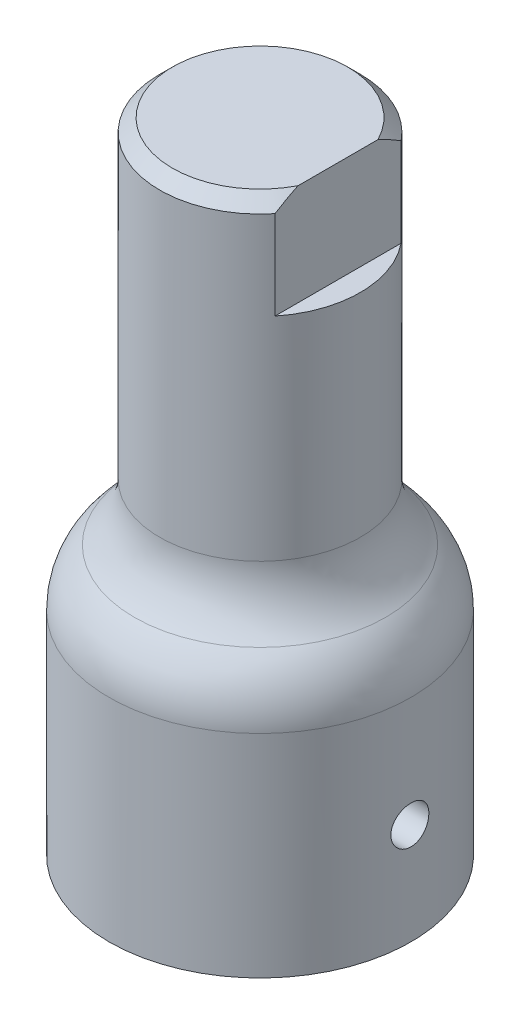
SolidWorks part; units mm, degrees
ref_plane "Front" through (0, 0, 0) normal (0, 0, 1) x (1, 0, 0)
ref_plane "Top" through (0, 0, 0) normal (0, 1, 0) x (-1, 0, 0)
ref_plane "Right" through (0, 0, 0) normal (1, 0, 0) x (0, 0, -1)
sketch "Sketch1" plane through (0, 0, 0) normal (0, 1, 0) x (-1, 0, 0)
  circle A0 centre (0, 0) radius 6.2865
  dimension "D1" = 12.573
extrude "Base-Extrude" add sketch "Sketch1" along normal blind 40
sketch "Sketch3" plane through (0, 0, 0) normal (0, 1, 0) x (-1, 0, 0)
  circle A1 centre (0, 0) radius 9.4615
  circle A2 centre (0, 0) radius 9.4615
  dimension "D1" = 3.175
extrude "Boss-Extrude1" add sketch "Sketch3" along normal blind 15.875
sketch "Sketch4" plane through (0, 0, 0) normal (0, 1, 0) x (-1, 0, 0)
  line L0 (-4.8895, 4.2479) -> (-4.8895, -4.2479)
  arc A1 (-4.8895, -4.2479) -> (-4.8895, 4.2479) centre (0, 0) ccw
  dimension "D2" = 6.477
  dimension "D3" = 6.477
  dimension "D1" = 1.5875
extrude "Cut-Extrude1" cut sketch "Sketch4" along normal blind 12.7
fillet "Fillet1" radius 4.7625 1 edges at (0, 15.875, 6.2865)
fillet "Fillet2" radius 4.7625 1 edges at (0, 15.875, 9.4615)
sketch "Sketch5" plane through (4.8895, 0, 0) normal (-1, 0, 0) x (0, 0, 1)
  line L0 (4.2479, 0) -> (-4.2479, 0) construction
  circle A0 centre (0, 6.35) radius 1.1906
  dimension "D2" = 2.3813
  dimension "D1" = 6.35
extrude "Cut-Extrude2" cut sketch "Sketch5" against normal through all
sketch "Sketch7" plane through (0, 40, 0) normal (0, 1, 0) x (-1, 0, 0)
  line L0 (-4.8895, 4.2479) -> (-4.8895, -4.2479) construction
  line L1 (-4.8895, 3.9513) -> (-4.8895, -3.9513)
  circle A1 centre (0, 0) radius 6.2865 construction
  arc A2 (-4.8895, 3.9513) -> (-4.8895, -3.9513) centre (0, 0) ccw
extrude "Cut-Extrude3" cut sketch "Sketch7" against normal blind 6.35
chamfer "Chamfer1" distance 0.7937 angle 45 1 edges at (-6.2865, 40, 0)
